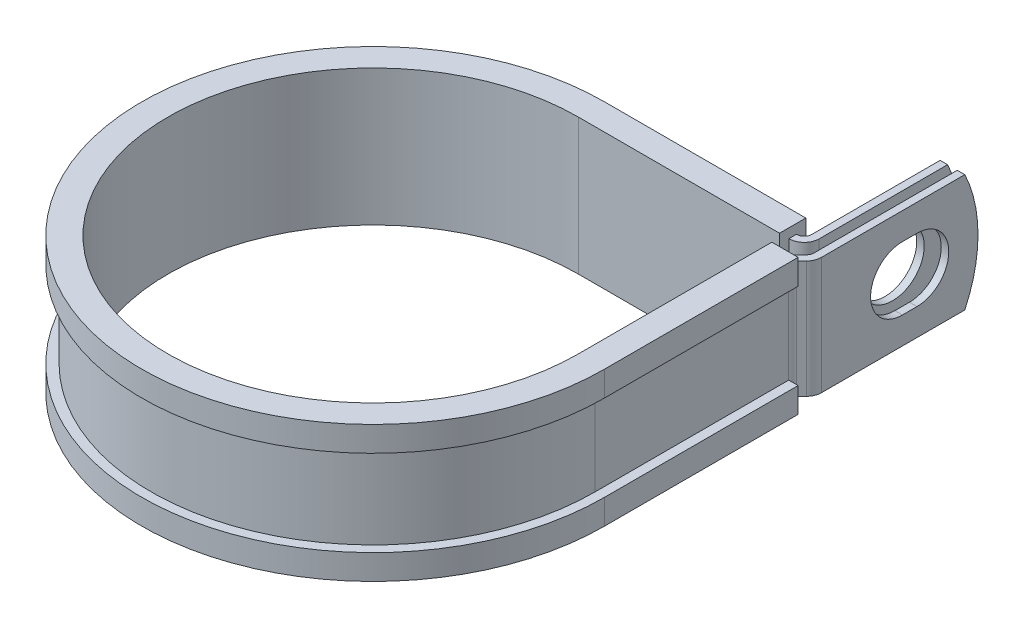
SolidWorks part; units mm, degrees
ref_plane "Front Plane" through (0, 0, 0) normal (0, 0, 1) x (1, 0, 0)
ref_plane "Top Plane" through (0, 0, 0) normal (0, 1, 0) x (1, 0, 0)
ref_plane "Right Plane" through (0, 0, 0) normal (1, 0, 0) x (0, 0, -1)
sketch "Sketch1" plane through (0, 0, 0) normal (0, 1, 0) x (1, 0, 0)
  line L0 (0, 34.8615) -> (32.7458, 34.8615)
  line L1 (34.8615, 0) -> (34.8615, 31.449)
  line L2 (35.1842, 60.2996) -> (35.1842, 37.2999)
  line L3 (35.5757, 33.1732) -> (36.4019, 33.9994)
  line L5 (36.759, 34.8615) -> (36.759, 60.2996)
  arc A0 (0, 34.8615) -> (34.8615, 0) centre (0, 0) ccw
  arc A1 (35.5757, 33.1732) -> (34.8615, 31.449) centre (37.2999, 31.449) ccw
  arc A2 (36.4019, 33.9994) -> (36.759, 34.8615) centre (35.5398, 34.8615) ccw
  arc A3 (32.7458, 34.8615) -> (35.1842, 37.2999) centre (32.7458, 37.2999) ccw
extrude "Extrude-Thin1" add sketch "Sketch1" along normal mid plane 19.05 thin
sketch "Sketch2" plane through (33.965, 0, 0) normal (-1, 0, 0) x (0, 0, 1)
  line L0 (-60.2996, 9.525) -> (-60.2996, -9.525) construction
  line L1 (0, 9.525) -> (0, -9.525) construction
  circle A0 centre (-49.1998, 0) radius 5.1562
  point P2 (-60.2996, 0)
extrude "Cut-Extrude1" cut sketch "Sketch2" against normal up to surface (1.2192 mm away)
sketch "Sketch3" plane through (37.9782, 0, 0) normal (1, 0, 0) x (0, 0, -1)
  line L0 (48.006, 0) -> (50.3936, 0) construction
  line L1 (48.006, 5.1562) -> (50.3936, 5.1562)
  line L2 (48.006, -5.1562) -> (50.3936, -5.1562)
  line L3 (60.2996, 9.525) -> (60.2996, -9.525) construction
  arc A0 (48.006, 5.1562) -> (48.006, -5.1562) centre (48.006, 0) ccw
  arc A1 (50.3936, -5.1562) -> (50.3936, 5.1562) centre (50.3936, 0) ccw
  point P3 (49.1998, 0)
  point P8 (60.2996, 0)
  point P11 (42.8498, 0)
  point P12 (55.5498, 0)
extrude "Cut-Extrude2" cut sketch "Sketch3" against normal up to surface (1.2192 mm away)
sketch "Sketch4" plane through (33.965, 0, 0) normal (-1, 0, 0) x (0, 0, 1)
  line L0 (-60.2996, 9.525) -> (-60.2996, -9.525)
  line L1 (-60.2996, 9.525) -> (-58.1551, 9.525)
  line L2 (-60.2996, 9.525) -> (-37.2999, 9.525) construction
  line L3 (-60.2996, -9.525) -> (-58.1551, -9.525)
  line L4 (-60.2996, -9.525) -> (-37.2999, -9.525) construction
  arc A0 (-58.1551, 9.525) -> (-58.1551, -9.525) centre (-38.0746, 0) ccw
extrude "Cut-Extrude3" cut sketch "Sketch4" against normal through all contours A0 M4 M5 | A0 L0 M2
ref_plane "Plane1" through (0, 0, -31.449) normal (0, 0, -1) x (-1, 0, 0)
ref_plane "Plane2" through (32.695, 0, 0) normal (-1, 0, 0) x (0, 0, 1)
sketch "Sketch5" plane through (0, 0, -31.449) normal (0, 0, -1) x (-1, 0, 0)
  line L0 (-36.0807, 9.525) -> (-34.8615, 9.525)
  line L1 (-36.0807, 9.525) -> (-36.0807, -9.525) construction
  line L3 (-34.8615, 9.525) -> (-34.8615, -9.525)
  line L4 (-34.8615, -9.525) -> (-36.0807, -9.525)
  line L5 (-36.0807, -9.525) -> (-36.0807, -6.985)
  line L6 (-36.0807, 9.525) -> (-36.0807, 6.985)
  line L7 (-37.6047, 11.049) -> (-37.6047, 6.985)
  line L8 (-37.6047, 11.049) -> (-33.3375, 11.049)
  line L9 (-33.3375, 11.049) -> (-33.3375, -11.049)
  line L10 (-33.3375, -11.049) -> (-37.6047, -11.049)
  line L11 (-37.6047, -11.049) -> (-37.6047, -6.985)
  line L12 (-37.6047, 6.985) -> (-36.0807, 6.985)
  line L13 (-36.0807, -6.985) -> (-37.6047, -6.985)
sketch "Sketch6" plane through (0, 9.525, 0) normal (0, 1, 0) x (1, 0, 0)
  line L0 (33.3375, 0) -> (33.3375, 31.449)
  line L1 (33.3375, 31.449) -> (37.6047, 31.449) construction
  line L2 (32.695, 6.9878) -> (32.695, -6.9878) construction
  line L5 (0, 33.3375) -> (32.695, 33.3375)
  arc A0 (0, 33.3375) -> (33.3375, 0) centre (0, 0) ccw
sweep "Sweep1" add profiles "Sketch5" path "Sketch6"
equation "\"D4@Sketch5\" = \"D1@Extrude-Thin1\""
equation "\"D5@Sketch5\" = \"D5@Extrude-Thin1\""
equation "\"D1@Sketch3\" = \"D2@Sketch2\""
equation "\"D7@Sketch1\" = \"D3@Sketch2\" + \"D1@Sketch3\""
equation "\"D1@Sketch1\" = \"D1@Sketch6\" + 2 * \"D3@Sketch5\""
equation "\"D1@Sketch4\" = ( \"D1@Extrude-Thin1\" + .125 ) * 2"
equation "\"D9@Sketch1\"= \"D5@Extrude-Thin1\""
equation "\"D8@Sketch1\"= 2 * \"D5@Extrude-Thin1\""
equation "\"D2@Sketch1\" = 2 * \"D5@Extrude-Thin1\""
equation "\"D2@Sketch3\" = \"D1@Sketch2\""
